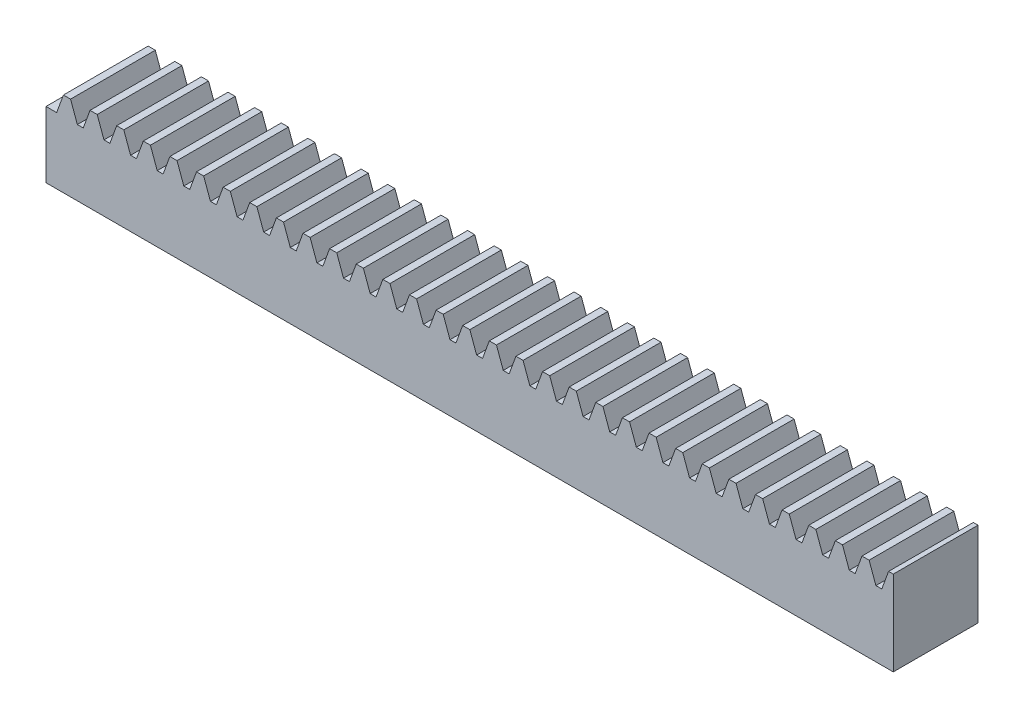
SolidWorks part; units mm, degrees
ref_plane "Ebene vorne" through (0, 0, 0) normal (0, 0, 1) x (1, 0, 0)
ref_plane "Ebene oben" through (0, 0, 0) normal (0, 1, 0) x (1, 0, 0)
ref_plane "Ebene rechts" through (0, 0, 0) normal (1, 0, 0) x (0, 0, -1)
imported_body "Importiert1"
sketch "Skizze1" plane through (250, 0, 0) normal (1, 0, 0) x (0, 0, -1)
  line L1 (-5, 0) -> (5, 0)
  line L2 (-5, 0) -> (-5, 10)
  line L3 (-5, 10) -> (5, 10)
  line L4 (5, 0) -> (5, 10)
extrude "Linear austragen1" cut sketch "Skizze1" against normal blind 150
